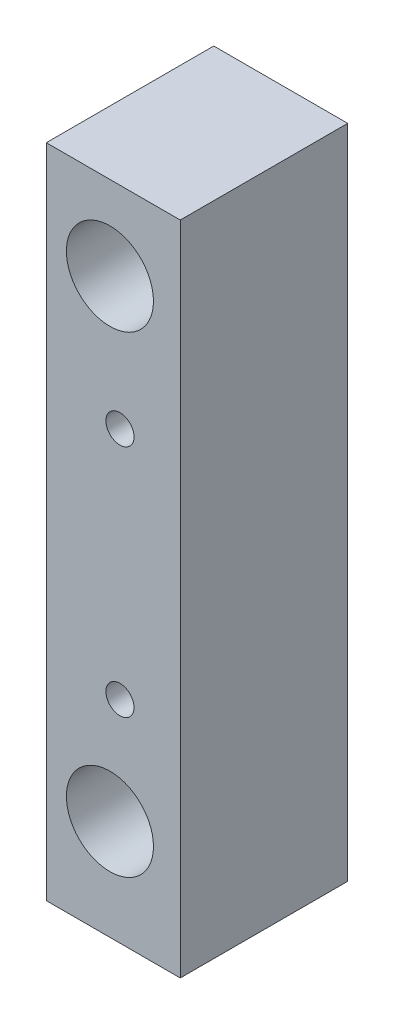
SolidWorks part; units mm, degrees
ref_plane "Face" through (0, 0, 0) normal (0, 0, 1) x (1, 0, 0)
ref_plane "Dessus" through (0, 0, 0) normal (0, 1, 0) x (1, 0, 0)
ref_plane "Droite" through (0, 0, 0) normal (1, 0, 0) x (0, 0, -1)
sketch "Esquisse1" plane through (0, 0, 0) normal (0, 0, 1) x (1, 0, 0)
  line L1 (0, 0) -> (40, 0)
  line L2 (0, 0) -> (0, 196)
  line L3 (0, 196) -> (40, 196)
  line L4 (40, 0) -> (40, 196)
  dimension "D1" = 196
  dimension "D2" = 40
extrude "Extrusion1" add sketch "Esquisse1" along normal blind 50
hole_wizard "Dégagement M81" positions "Esquisse5" profile "Esquisse4" hole size "M8" standard "ISO"
sketch "Esquisse5" plane through (0, 0, 50) normal (0, 0, 1) x (1, 0, 0)
  line L0 (0, 98) -> (40, 98) construction
  line L1 (40, 0) -> (40, 196) construction
  line L2 (0, 196) -> (0, 0) construction
  point P0 (22, 133)
  point P7 (22, 63)
  dimension "D1" = 35
  dimension "D2" = 22
sketch "Esquisse4" plane through (22, 133, 50) normal (1, 0, 0) x (0, -1, 0)
  line L0 (0, 0) -> (0, 50)
  line L1 (0, 50) -> (4.2, 50)
  line L2 (4.2, 50) -> (4.2, 0)
  line L5 (4.2, 0) -> (0, 0)
  line L11 (0, -6.35) -> (0, 107.95) construction
  dimension "Diamètre du perçage jusqu'au prochain" = 8.4
  dimension "Profondeur du perçage jusqu'au prochain" = 50
sketch "Esquisse6" plane through (0, 0, 50) normal (0, 0, 1) x (1, 0, 0)
  line L0 (0, 98) -> (40, 98) construction
  line L1 (0, 196) -> (0, 0) construction
  line L2 (40, 0) -> (40, 196) construction
  circle A0 centre (19, 171) radius 13
  circle A1 centre (19, 30) radius 13
  dimension "D1" = 26
  dimension "D2" = 26
  dimension "D3" = 19
  dimension "D4" = 19
  dimension "D5" = 68
  dimension "D6" = 73
extrude "Enlèv. mat.-Extru.1" cut sketch "Esquisse6" against normal through all
